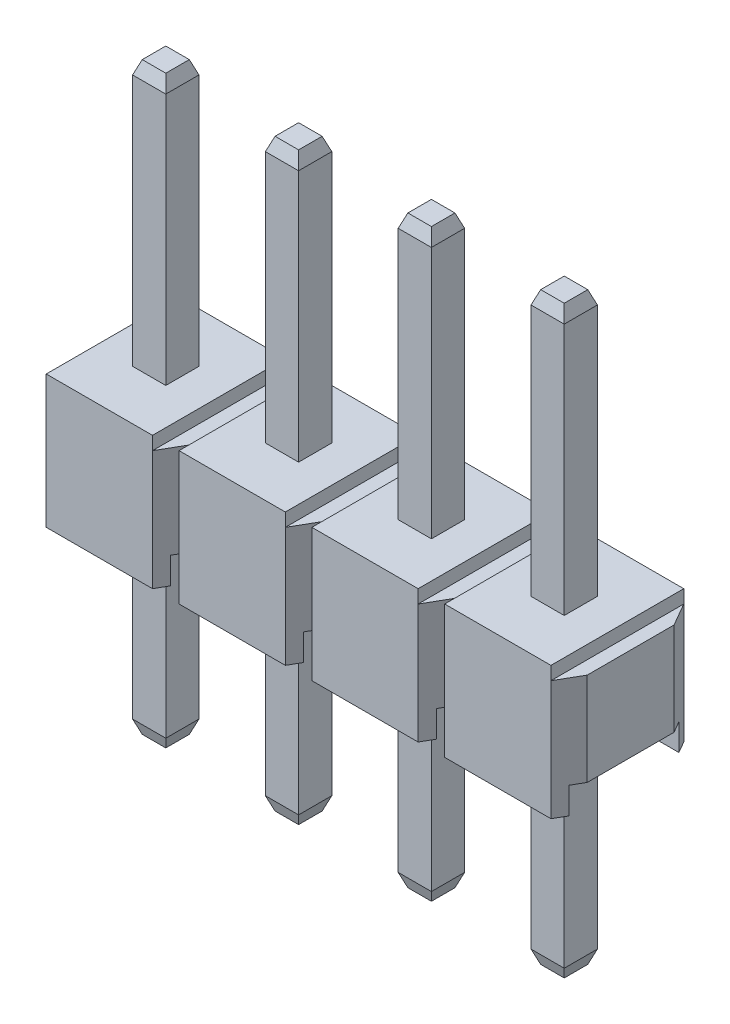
SolidWorks part; units mm, degrees
ref_plane "Front" through (0, 0, 0) normal (0, 0, 1) x (1, 0, 0)
ref_plane "Top" through (0, 0, 0) normal (0, 1, 0) x (1, 0, 0)
ref_plane "Right" through (0, 0, 0) normal (1, 0, 0) x (0, 0, -1)
sketch "Эскиз2" plane through (0, 0, 0) normal (0, 1, 0) x (1, 0, 0)
  line L0 (-1, 0.6536) -> (-0.8, 1)
  line L1 (-0.8, 1) -> (0.8, 1)
  line L2 (-1, 0.6536) -> (-1, -0.6536)
  line L3 (-0.8, -1) -> (0.8, -1)
  line L4 (1, 0.6536) -> (1, -0.6536)
  line L5 (0.8, 1) -> (1, 0.6536)
  line L6 (0.8, -1) -> (1, -0.6536)
  line L7 (-1, -0.6536) -> (-0.8, -1)
  line L8 (0, -1) -> (0, 1) construction
  dimension "D1" = 2
  dimension "D2" = 2
  dimension "D3" = 60
  dimension "D4" = 1
  dimension "D5" = 60
  dimension "D6" = 0.2
extrude "Вытянуть2" add sketch "Эскиз2" along normal blind 2
sketch "Эскиз3" plane through (0, 0, 0) normal (1, 0, 0) x (0, 0, -1)
  line L0 (-1, 0) -> (-0.6536, 0) construction
  line L1 (-0.8268, 0) -> (0.8268, 0)
  line L2 (-0.8268, 0) -> (-0.8268, 0.4)
  line L3 (-0.8268, 0.4) -> (0.8268, 0.4)
  line L4 (0.8268, 0) -> (0.8268, 0.4)
  line L5 (0.6536, 0) -> (1, 0) construction
  dimension "D1" = 0.4
extrude "Вырез-Вытянуть1" cut sketch "Эскиз3" against normal mid plane 2
sketch "Эскиз4" plane through (0, 0, 0) normal (0, 0, 1) x (1, 0, 0)
  line L1 (-1, 2) -> (-0.8, 2)
  line L2 (-1, 2) -> (-1, 1.8)
  line L3 (-1, 1.8) -> (-0.8, 1.8)
  line L4 (-0.8, 2) -> (-0.8, 1.8)
  line L5 (1, 2) -> (0.8, 2)
  line L6 (1, 2) -> (1, 1.8)
  line L7 (1, 1.8) -> (0.8, 1.8)
  line L8 (0.8, 2) -> (0.8, 1.8)
  dimension "D1" = 0.2
extrude "Вырез-Вытянуть2" cut sketch "Эскиз4" against normal through all and the other way through all
sketch "Эскиз1" plane through (0, 0, 0) normal (0, 1, 0) x (1, 0, 0)
  line L0 (-0.25, 0) -> (0.25, 0) construction
  line L1 (-0.25, 0.25) -> (0.25, 0.25)
  line L2 (-0.25, 0.25) -> (-0.25, -0.25)
  line L3 (-0.25, -0.25) -> (0.25, -0.25)
  line L4 (0.25, 0.25) -> (0.25, -0.25)
  dimension "D1" = 0.5
extrude "Вытянуть1" add sketch "Эскиз1" along normal blind 6 and the other way blind 2.8
chamfer "Фаска1" distance 0.2 angle 20 4 edges at (0, 6, -0.25) (0.25, 6, 0) (0, 6, 0.25) (-0.25, 6, 0)
chamfer "Фаска2" distance 0.2 angle 20 4 edges at (0, -2.8, 0.25) (0.25, -2.8, 0) (0, -2.8, -0.25) (-0.25, -2.8, 0)
pattern_linear "Линейный массив1" count 4 spacing 2 along (-1, 0, 0) of "Вытянуть2", "Вырез-Вытянуть1", "Вырез-Вытянуть2"
pattern_linear "Линейный массив2" count 100 spacing 2 along (-1, 0, 0) of "Вытянуть1", "Фаска1", "Фаска2"
